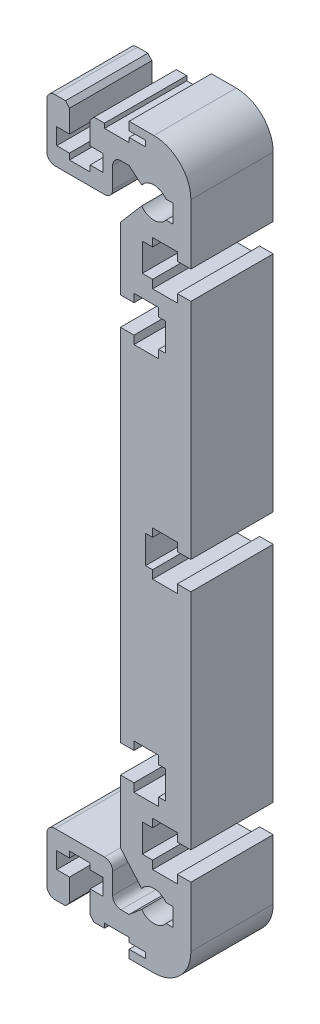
SolidWorks part; units mm, degrees
ref_plane "Ebene vorne" through (0, 0, 0) normal (0, 0, 1) x (1, 0, 0)
ref_plane "Ebene oben" through (0, 0, 0) normal (0, 1, 0) x (1, 0, 0)
ref_plane "Ebene rechts" through (0, 0, 0) normal (1, 0, 0) x (0, 0, -1)
sketch "Skizze1" plane through (0, 0, 0) normal (0, 0, 1) x (1, 0, 0)
  line L0 (0, -32.9008) -> (0, -25.25)
  line L1 (4.06, -38.85) -> (4.06, -35.15) construction
  line L2 (-8.9421, -41.35) -> (-8.9421, -35.85)
  line L3 (8.5579, -28.85) -> (6.9079, -28.85)
  line L4 (8.5579, -39.55) -> (8.5579, -32.25)
  line L5 (5.4979, -25.25) -> (5.4979, -21.85)
  line L6 (-7.9421, -42.35) -> (-6.669, -42.35)
  line L7 (0, 0) -> (8.5579, 0) construction
  line L8 (3.0579, -43.05) -> (3.0579, -42.35)
  line L9 (1.0579, -41.8) -> (-1.9421, -41.8)
  line L10 (8.5579, -28.85) -> (8.5579, -1.7)
  line L11 (0.0579, -39.4) -> (1.0569, -39.4)
  line L12 (6.41, -35.9) -> (5.5474, -35.9)
  line L13 (6.41, -38.1) -> (5.5474, -38.1)
  line L14 (6.41, -38.1) -> (6.41, -35.9)
  line L15 (-6.19, -41.8) -> (-6.669, -42.35)
  line L16 (-3.69, -41.8) -> (-3.211, -42.35)
  line L17 (-1.9421, -42.35) -> (-1.9421, -41.8)
  line L18 (2.5726, -35.9) -> (0, -32.9008)
  line L19 (-7.9421, -34.85) -> (-1.9421, -34.85)
  line L20 (-0.9421, -38.4) -> (-0.9421, -35.85)
  line L21 (-2.14, -37.08) -> (-3.69, -37.08)
  line L22 (-6.19, -41.8) -> (-6.19, -39.08)
  line L23 (-6.19, -36.35) -> (-3.69, -36.35)
  line L24 (4.6479, -26.25) -> (1.6479, -26.25)
  line L25 (-3.69, -41.8) -> (-3.69, -39.08)
  line L26 (-3.69, -39.08) -> (-2.14, -39.08)
  line L27 (-4.94, -42.35) -> (-4.94, -36.35) construction
  line L28 (2.5726, -37) -> (8.5579, -37) construction
  line L29 (-7.74, -37.08) -> (-6.19, -37.08)
  line L30 (-3.211, -42.35) -> (-1.9421, -42.35)
  line L31 (-7.74, -39.08) -> (-7.74, -37.08)
  line L32 (-2.14, -39.08) -> (-2.14, -37.08)
  line L33 (-3.69, -37.08) -> (-3.69, -36.35)
  line L34 (-6.19, -37.08) -> (-6.19, -36.35)
  line L35 (-7.74, -39.08) -> (-6.19, -39.08)
  line L36 (1.0579, -42.35) -> (1.0579, -41.8)
  line L37 (1.0579, -42.35) -> (3.0579, -42.35)
  line L38 (0, -21.85) -> (0, 0)
  line L39 (3.0579, -1.7) -> (3.0579, 0)
  line L40 (3.0579, 0) -> (0, 0)
  line L41 (3.0579, -43.05) -> (1.0579, -43.05)
  line L42 (1.0579, -44.05) -> (1.0579, -43.05)
  line L43 (1.0579, -44.05) -> (4.0579, -44.05)
  line L49 (0, -25.25) -> (1.6479, -25.25)
  line L51 (4.6479, -26.25) -> (4.6479, -25.25)
  line L52 (6.9079, -28.85) -> (6.9079, -27.85)
  line L53 (6.9079, -27.85) -> (3.9079, -27.85)
  line L54 (3.9079, -28.85) -> (3.9079, -27.85)
  line L55 (2.6579, -28.85) -> (3.9079, -28.85)
  line L56 (2.6579, -32.25) -> (2.6579, -28.85)
  line L57 (6.9079, -33.25) -> (6.9079, -32.25)
  line L61 (2.6579, -32.25) -> (3.9079, -32.25)
  line L62 (1.6479, -26.25) -> (1.6479, -25.25)
  line L64 (1.6479, -21.85) -> (1.6479, -20.85)
  line L101 (3.9079, -33.25) -> (3.9079, -32.25)
  line L108 (6.9079, -33.25) -> (3.9079, -33.25)
  line L109 (6.9079, -1.7) -> (8.5579, -1.7)
  line L110 (3.9079, -2.7) -> (6.9079, -2.7)
  line L111 (3.0579, -1.7) -> (3.9079, -1.7)
  line L116 (8.5579, -32.25) -> (6.9079, -32.25)
  line L120 (4.6479, -25.25) -> (5.4979, -25.25)
  line L124 (0, -21.85) -> (1.6479, -21.85)
  line L126 (8.5579, -23.55) -> (0, -23.55) construction
  line L133 (6.9079, -2.7) -> (6.9079, -1.7)
  line L134 (3.9079, -2.7) -> (3.9079, -1.7)
  line L135 (2.6579, -30.55) -> (8.5579, -30.55) construction
  line L136 (1.0569, -39.4) -> (2.5726, -38.1)
  line L140 (4.6479, -21.85) -> (4.6479, -20.85)
  line L141 (4.6479, -21.85) -> (5.4979, -21.85)
  line L143 (4.6479, -20.85) -> (1.6479, -20.85)
  arc A0 (4.0579, -44.05) -> (8.5579, -39.55) centre (4.0579, -39.55) ccw
  arc A1 (5.5474, -35.9) -> (2.5726, -35.9) centre (4.06, -37) ccw
  arc A2 (2.5726, -38.1) -> (5.5474, -38.1) centre (4.06, -37) ccw
  arc A3 (-8.9421, -41.35) -> (-7.9421, -42.35) centre (-7.9421, -41.35) ccw
  arc A4 (-7.9421, -34.85) -> (-8.9421, -35.85) centre (-7.9421, -35.85) ccw
  arc A12 (-0.9421, -38.4) -> (0.0579, -39.4) centre (0.0579, -38.4) ccw
  arc A13 (-0.9421, -35.85) -> (-1.9421, -34.85) centre (-1.9421, -35.85) ccw
  dimension "D6" = 1
  dimension "D7" = 1.85
  dimension "D15" = 4.5
  dimension "D1" = 3.4
  dimension "D2" = 5.4
  dimension "D4" = 3
  dimension "D5" = 17.5
  dimension "D9" = 5.4
  dimension "D11" = 3
  dimension "D13" = 23.55
  dimension "D16" = 30.55
  dimension "D17" = 3.4
  dimension "D18" = 5.4
  dimension "D19" = 3
  dimension "D23" = 37
  dimension "D24" = 2.2
  dimension "D26" = 90
  dimension "D27" = 2.55
  dimension "D28" = 2.2
  dimension "D31" = 2.4
  dimension "D32" = 44.05
  dimension "D33" = 9.2
  dimension "D36" = 6
  dimension "D37" = 5.5
  dimension "D41" = 0.7
  dimension "D42" = 1
  dimension "D43" = 3
  dimension "D44" = 2.25
  dimension "D46" = 82.1
  dimension "D49" = 2
extrude "Aufsatz-Linear austragen1" add sketch "Skizze1" along normal blind 10
mirror "Spiegeln1" about plane through (3.0579, 0, 10) normal (0, -1, 0)
